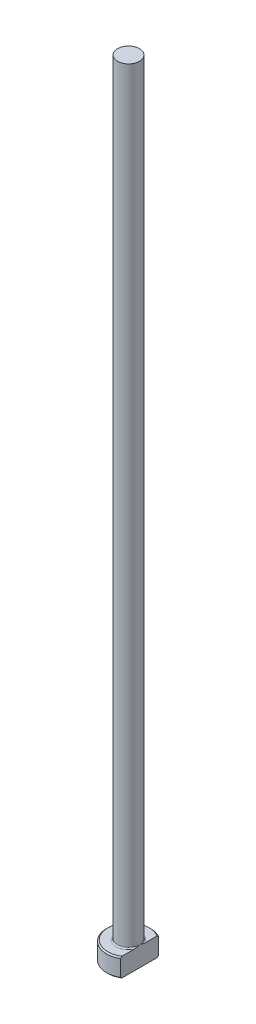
SolidWorks part; units mm, degrees
ref_plane "Front Plane" through (0, 0, 0) normal (0, 0, 1) x (1, 0, 0)
ref_plane "Top Plane" through (0, 0, 0) normal (0, 1, 0) x (1, 0, 0)
ref_plane "Right Plane" through (0, 0, 0) normal (1, 0, 0) x (0, 0, -1)
sketch "Sketch1" plane through (0, 0, 0) normal (0, 0, 1) x (1, 0, 0)
  line L0 (0, 259.9588) -> (0, -15.1925) construction
  line L1 (0, 0) -> (-3.5, 0)
  line L2 (-3.5, 0) -> (-3.5, 3)
  line L3 (-3.5, 3) -> (-1.75, 3)
  line L4 (-1.75, 3) -> (-1.75, 125)
  line L5 (-1.75, 125) -> (0, 125)
  line L6 (0, 125) -> (0, 0)
  dimension "L" = 125
  dimension "H" = 7
  dimension "T" = 3
  dimension "D" = 3.5
revolve "Revolve1" add sketch "Sketch1" angle 360 about L0
chamfer "Chamfer1" distance 0.2 angle 45 2 edges at (0, 3, 3.5) (0, 0, 3.5)
fillet "Fillet1" radius 0.2 1 edges at (0, 3, 1.75)
sketch "Sketch2" plane through (0, 0, 0) normal (0, 1, 0) x (1, 0, 0)
  line L0 (1.75, 3.0311) -> (1.75, -3.0311)
  circle A0 centre (0, 0) radius 3.5 construction
  arc A1 (1.75, -3.0311) -> (1.75, 3.0311) centre (0, 0) ccw
  circle A2 centre (0, 0) radius 1.75 construction
extrude "KEY" cut sketch "Sketch2" along normal through all
